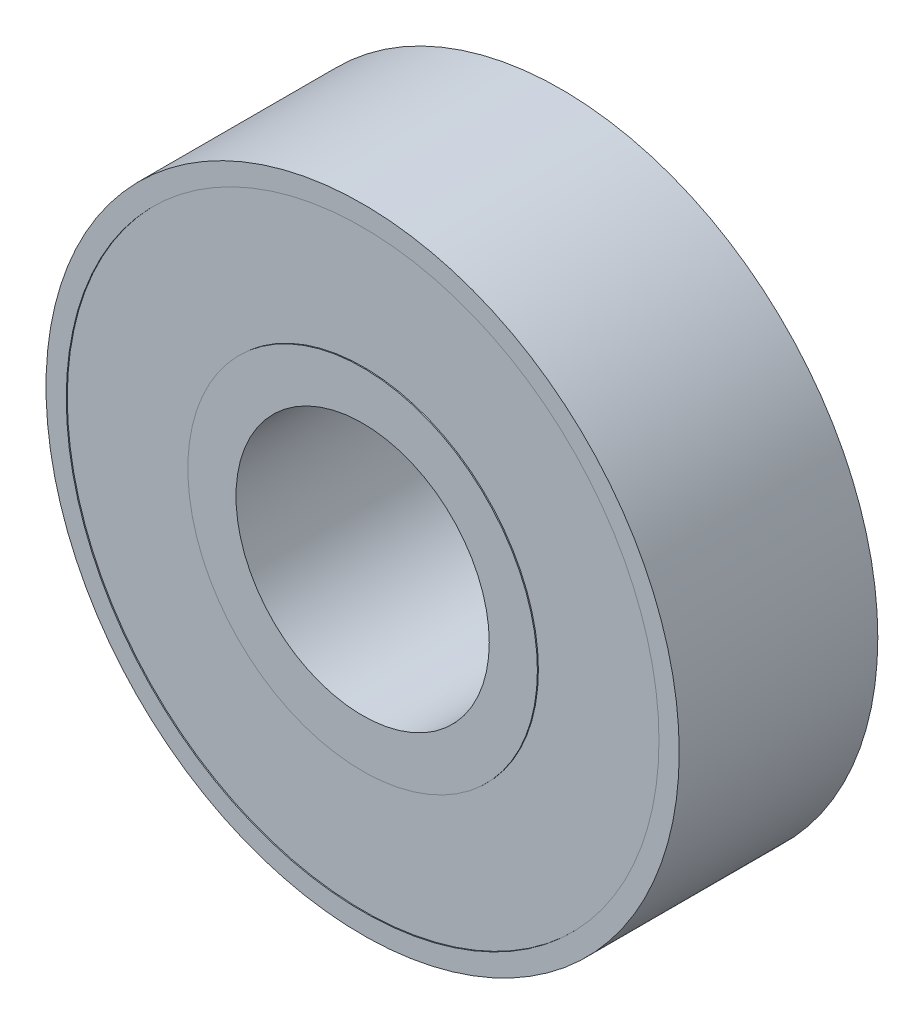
SolidWorks part; units mm, degrees
ref_plane "Front Plane" through (0, 0, 0) normal (0, 0, 1) x (1, 0, 0)
ref_plane "Top Plane" through (0, 0, 0) normal (0, 1, 0) x (1, 0, 0)
ref_plane "Right Plane" through (0, 0, 0) normal (1, 0, 0) x (0, 0, -1)
sketch "Sketch1" plane through (0, 0, 0) normal (0, 0, 1) x (1, 0, 0)
  circle A0 centre (0, 0) radius 7.9375
  circle A1 centre (0, 0) radius 3.175
  dimension "D1" = 15.875
  dimension "D2" = 6.35
extrude "Boss-Extrude1" add sketch "Sketch1" along normal mid plane 4.9784
sketch "Sketch3" plane through (0, 0, 2.4892) normal (0, 0, 1) x (1, 0, 0)
  circle A0 centre (0, 0) radius 7.4295
  circle A1 centre (0, 0) radius 4.3815
  circle A2 centre (0, 0) radius 7.9375 construction
  dimension "D1" = 3.048
  dimension "D2" = 0.508
extrude "Cut-Extrude1" cut sketch "Sketch3" against normal blind 0.0254
mirror "Mirror1" about plane through (0, 0, 0) normal (0, 0, 1) of "Cut-Extrude1"
